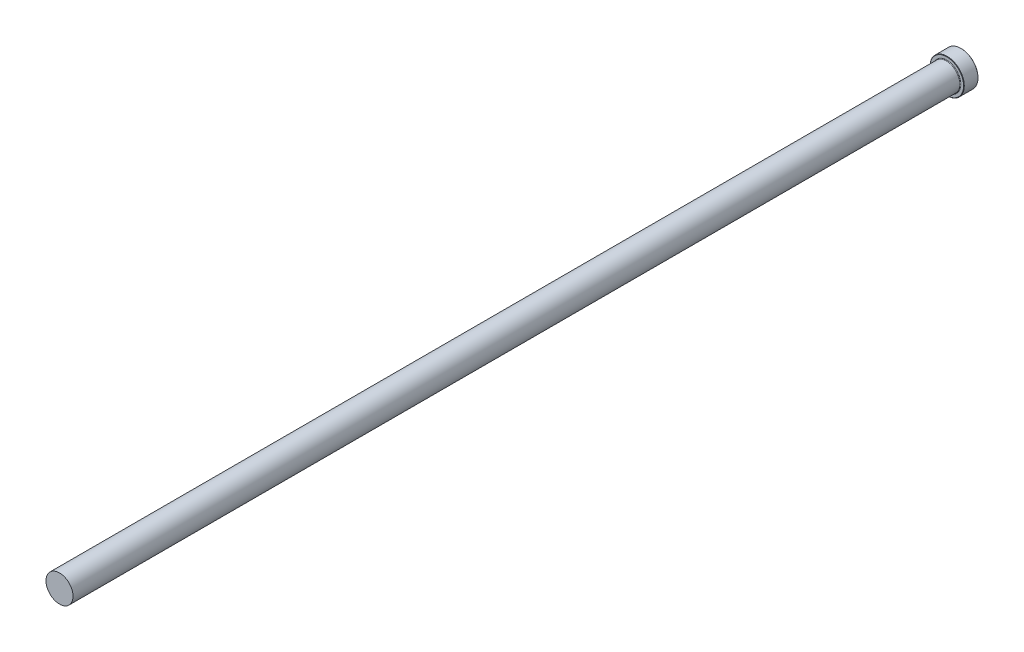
SolidWorks part; units mm, degrees
ref_plane "Front Plane" through (0, 0, 0) normal (0, 0, 1) x (1, 0, 0)
ref_plane "Top Plane" through (0, 0, 0) normal (0, 1, 0) x (1, 0, 0)
ref_plane "Right Plane" through (0, 0, 0) normal (1, 0, 0) x (0, 0, -1)
sketch "Sketch1" plane through (0, 0, 0) normal (1, 0, 0) x (0, 0, -1)
  line L0 (0, 0) -> (0, 9.5)
  line L1 (0, 10.45) -> (0, -10.45) construction
  line L2 (0, 9.5) -> (-8, 9.5)
  line L3 (-8, 9.5) -> (-8, 7.8)
  line L4 (-8.3, 7.5) -> (-500, 7.5)
  line L5 (-500, 7.5) -> (-500, 0)
  line L6 (10.45, 0) -> (-10.45, 0) construction
  line L7 (-500, 0) -> (0, 0)
  line L8 (-109.0506, 0) -> (16.9928, 0) construction
  arc A0 (-8, 7.8) -> (-8.3, 7.5) centre (-8.3, 7.8) cw
  dimension "D1" = 0.3
  dimension "D2" = 19
  dimension "D3" = 15
  dimension "D4" = 500
  dimension "D5" = 8
revolve "Revolve1" add sketch "Sketch1" angle 360 about L8
chamfer "Chamfer1" distance 0.2 angle 45 2 edges at (9.5, 0, 0) (9.5, 0, 8)
